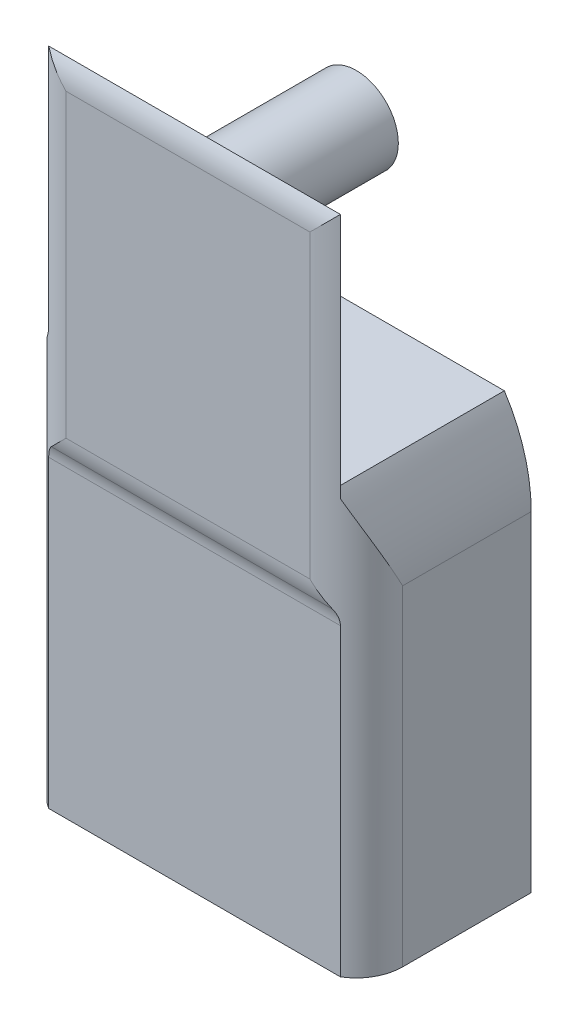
SolidWorks part; units mm, degrees
ref_plane "Front Plane" through (0, 0, 0) normal (0, 0, 1) x (1, 0, 0)
ref_plane "Top Plane" through (0, 0, 0) normal (0, 1, 0) x (1, 0, 0)
ref_plane "Right Plane" through (0, 0, 0) normal (1, 0, 0) x (0, 0, -1)
sketch "Sketch1" plane through (0, 0, 0) normal (0, 0, 1) x (1, 0, 0)
  line L0 (0, 101.6) -> (0, 75.2) construction
  line L1 (0, 0) -> (50.8, 0)
  line L3 (0, 101.6) -> (50.8, 101.6)
  line L4 (50.8, 0) -> (50.8, 101.6)
  line L5 (0, 75.2) -> (50.8, 75.2) construction
  line L6 (0, 101.6) -> (0, 0)
  arc A0 (0, 101.6) -> (50.8, 101.6) centre (25.4, 100.6189) ccw
  dimension "D1" = 26.4
  dimension "D2" = 101.6
  dimension "D3" = 50.8
extrude "Boss-Extrude1" add sketch "Sketch1" along normal blind 25.4 contours A0 L6 L1 L4
sketch "Sketch2" plane through (0, 0, 25.4) normal (0, 0, 1) x (1, 0, 0)
  line L0 (0, 75.2) -> (50.8, 75.2) construction
  line L1 (50.8, 0) -> (50.8, 99.6379) construction
  line L2 (25.4, 75.2) -> (25.4, 88.9)
  line L3 (0, 75.2) -> (0, 48.8937)
  line L4 (0, 99.6379) -> (50.8, 99.6379)
  line L5 (0, 99.6379) -> (0, 75.2)
  line L6 (0, 75.2) -> (50.8, 75.2)
  line L7 (50.8, 99.6379) -> (50.8, 75.2)
  line L8 (0, 99.6379) -> (0, 0) construction
  line L9 (0, 48.8937) -> (50.8, 48.8937)
  line L10 (50.8, 48.8937) -> (50.8, 75.2)
  circle A1 centre (25.4, 88.9) radius 6.35
  point P3 (25.4, 75.2)
  dimension "D2" = 12.7
  dimension "D1" = 13.7
extrude "Boss-Extrude3" add sketch "Sketch2" along normal blind 1
sketch "Sketch3" plane through (0, 0, 26.4) normal (0, 0, 1) x (1, 0, 0)
  circle A0 centre (25.4, 88.9) radius 6.35
extrude "Boss-Extrude4" add sketch "Sketch3" against normal blind 25.4
sketch "Sketch4" plane through (0, 0, 0) normal (0, 0, -1) x (-1, 0, 0)
  line L0 (-50.8, 75.2) -> (0, 75.2)
  line L1 (0, 99.6379) -> (0, 0) construction
  line L2 (-50.8, 75.2) -> (-50.8, 99.6379)
  line L3 (0, 75.2) -> (0, 99.6379)
  arc A1 (-50.8, 99.6379) -> (0, 99.6379) centre (-25.4, 100.6189) ccw construction
  arc A2 (-50.8, 99.6379) -> (0, 99.6379) centre (-25.4, 100.6189) ccw
  point P3 (-25.4, 75.2)
extrude "Cut-Extrude1" cut sketch "Sketch4" against normal blind 25.4 contours L0 M1 M4 | L0 M2 M1
sketch "Sketch5" plane through (0, 0, 0) normal (0, 0, -1) x (-1, 0, 0)
  line L0 (-25.4, 75.2) -> (-25.4, 49.8) construction
  line L1 (-50.8, 75.2) -> (0, 75.2) construction
  line L2 (0, 75.2) -> (0, 0) construction
  line L3 (-50.8, 75.2) -> (0, 75.2)
  line L4 (-50.8, 0) -> (-50.8, 75.2) construction
  line L6 (-50.8, 49.8) -> (-50.8, 75.2)
  line L7 (0, 75.2) -> (0, 49.8)
  arc A1 (-50.8, 49.8) -> (0, 49.8) centre (-25.4, 49.8) cw
  dimension "D1" = 25.4
extrude "Cut-Extrude5" cut sketch "Sketch5" against normal blind 25.4 contours A1 M4 M7 | A1 L3 M5
fillet "Fillet5" radius 5 1 edges at (25.4, 48.8937, 25.4)
sketch "Sketch6" plane through (0, 0, 0) normal (0, 0, -1) x (-1, 0, 0)
  line L0 (-46.7485, 63.5622) -> (-4.0515, 63.5622)
  arc A0 (0, 49.8) -> (-50.8, 49.8) centre (-25.4, 49.8) ccw construction
  arc A1 (-4.0515, 63.5622) -> (-46.7485, 63.5622) centre (-25.4, 49.8) ccw
extrude "Cut-Extrude6" cut sketch "Sketch6" against normal blind 25.4
fillet "Fillet6" radius 7 4 edges at (50.8, 74.2658, 26.4) (25.4, 48.8937, 26.4) (0, 74.2658, 26.4) (25.4, 99.6379, 26.4)
